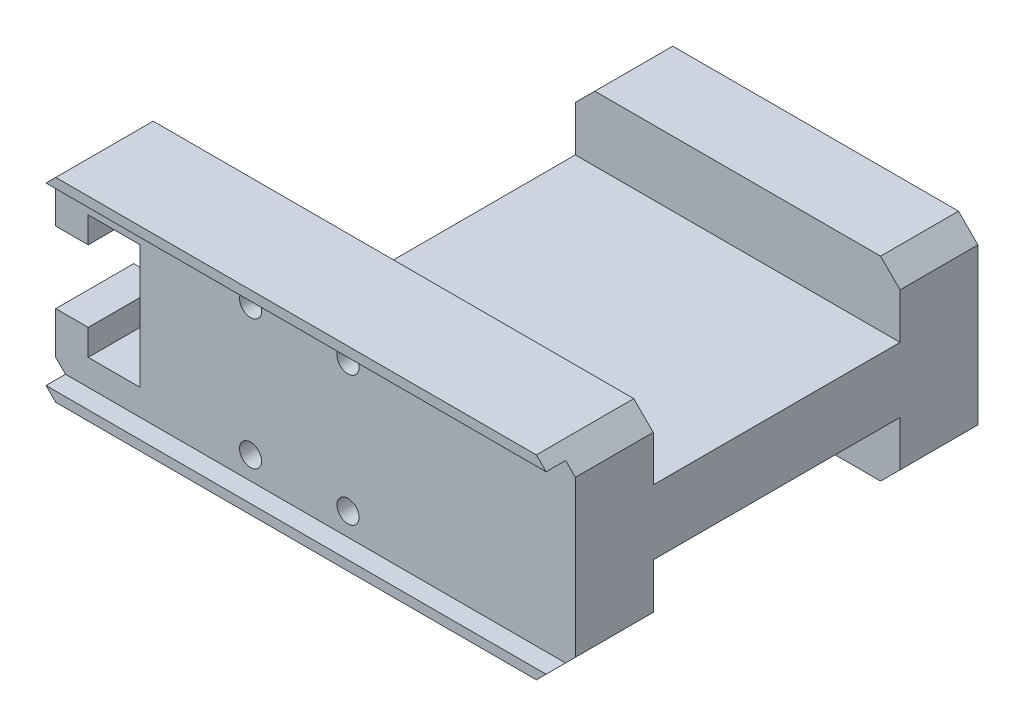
SolidWorks part; units mm, degrees
ref_plane "前视基准面" through (0, 0, 0) normal (0, 0, 1) x (1, 0, 0)
ref_plane "上视基准面" through (0, 0, 0) normal (0, 1, 0) x (1, 0, 0)
ref_plane "右视基准面" through (0, 0, 0) normal (1, 0, 0) x (0, 0, -1)
sketch "草图1" plane through (0, 0, 0) normal (0, 0, 1) x (1, 0, 0)
  line L1 (-40, -15) -> (40, -15)
  line L2 (-40, -15) -> (-40, 15)
  line L3 (-40, 15) -> (40, 15)
  line L4 (40, -15) -> (40, 15)
  line L5 (-40, -15) -> (40, 15) construction
  line L6 (-40, 15) -> (40, -15) construction
  point P0 (0, 0)
  dimension "D1" = 80
  dimension "D2" = 30
extrude "凸台-拉伸1" add sketch "草图1" along normal mid plane 65
sketch "草图2" plane through (0, 0, 32.5) normal (0, 0, 1) x (1, 0, 0)
  line L1 (-70.0409, -13.5) -> (70.0409, -13.5)
  line L2 (-70.0409, -13.5) -> (-70.0409, 13.5)
  line L3 (-70.0409, 13.5) -> (70.0409, 13.5)
  line L4 (70.0409, -13.5) -> (70.0409, 13.5)
  line L5 (-70.0409, -13.5) -> (70.0409, 13.5) construction
  line L6 (-70.0409, 13.5) -> (70.0409, -13.5) construction
  point P0 (0, 0)
  dimension "D1" = 27
extrude "切除-拉伸1" cut sketch "草图2" against normal blind 3
hole_wizard "Ø3.4 (3.4) 直径孔1" positions "草图4" profile "草图3" hole size "Ø3.4" standard "GB"
sketch "草图4" plane through (30.1404, -0.2316, 29.5) normal (0, 0, -1) x (-1, 0, 0)
  line L0 (70.1404, 15.2316) -> (70.1404, -14.7684) construction
  point P0 (25.1404, 10.2316)
  point P1 (40.1404, 10.2316)
  point P3 (40.1404, -9.7684)
  point P5 (25.1404, -9.7684)
  dimension "D1" = 15
  dimension "D2" = 30
  dimension "D3" = 20
  dimension "D4" = 10
sketch "草图3" plane through (5, 10, 29.5) normal (1, 0, 0) x (0, -1, 0)
  line L0 (0, 0) -> (0, 21.0215)
  line L1 (0, 21.0215) -> (1.7, 20)
  line L2 (1.7, 20) -> (1.7, 0)
  line L5 (1.7, 0) -> (0, 0)
  line L10 (0, 21.0215) -> (-1.7, 20) construction
  line L11 (0, -6.35) -> (0, 107.95) construction
  dimension "孔直径" = 3.4
  dimension "孔深度" = 20
  dimension "导头角度" = 118
sketch "草图5" plane through (0, 0, -32.5) normal (0, 0, -1) x (-1, 0, 0)
  line L0 (40, 15) -> (40, -15) construction
  line L1 (35, -5.5) -> (45, -5.5)
  line L2 (35, -5.5) -> (35, 5.5)
  line L3 (35, 5.5) -> (45, 5.5)
  line L4 (45, -5.5) -> (45, 5.5)
  line L5 (35, -5.5) -> (45, 5.5) construction
  line L6 (35, 5.5) -> (45, -5.5) construction
  point P0 (40, 0)
  dimension "D1" = 11
  dimension "D2" = 5
extrude "切除-拉伸2" cut sketch "草图5" against normal through all
sketch "草图6" plane through (0, 0, -32.5) normal (0, 0, -1) x (-1, 0, 0)
  line L0 (35, 5.5) -> (35, -5.5) construction
  line L1 (27, -9.5) -> (35, -9.5)
  line L2 (27, -9.5) -> (27, 9.5)
  line L3 (27, 9.5) -> (35, 9.5)
  line L4 (35, -9.5) -> (35, 9.5)
  line L5 (27, -9.5) -> (35, 9.5) construction
  line L6 (27, 9.5) -> (35, -9.5) construction
  point P0 (31, 0)
  dimension "D1" = 8
  dimension "D2" = 19
extrude "切除-拉伸3" cut sketch "草图6" against normal through all
hole_wizard "M5 螺纹孔2" positions "草图10" profile "草图9" tap size "M5" standard "GB"
sketch "草图10" plane through (0, 0, -32.5) normal (0, 0, -1) x (-1, 0, 0)
  line L3 (-40, -15) -> (-40, 15) construction
  point P3 (-10, 0)
  dimension "D1" = 30
sketch "草图9" plane through (10, 0, -32.5) normal (1, 0, 0) x (0, 1, 0)
  line L0 (0, 0) -> (0, 21.2618)
  line L1 (0, 21.2618) -> (2.1, 20)
  line L2 (2.1, 20) -> (2.1, 0)
  line L5 (2.1, 0) -> (0, 0)
  line L10 (0, 21.2618) -> (-2.1, 20) construction
  line L11 (0, -6.35) -> (0, 107.95) construction
  dimension "螺纹孔钻头直径" = 4.2
  dimension "螺纹孔钻头深度" = 20
  dimension "导头角度" = 118
sketch "草图13" plane through (0, -15, 0) normal (0, -1, 0) x (1, 0, 0)
  line L0 (-40, -32.5) -> (40, -32.5) construction
  line L1 (-51.858, 17.5) -> (69.2984, 17.5)
  line L2 (-51.858, 17.5) -> (-51.858, -20.5)
  line L3 (-51.858, -20.5) -> (69.2984, -20.5)
  line L4 (69.2984, 17.5) -> (69.2984, -20.5)
  line L5 (-40, 32.5) -> (40, 32.5) construction
  dimension "D1" = 12
  dimension "D2" = 15
extrude "切除-拉伸4" cut sketch "草图13" against normal blind 10
mirror "镜向1" about plane through (0, 0, 0) normal (0, 1, 0) of "切除-拉伸4"
sketch "草图14" plane through (-5.75, 0, -32.5) normal (0, 0, 1) x (1, 0, 0)
  line L0 (45.75, -15) -> (45.75, 15) construction
  line L1 (-62.1057, 42.7143) -> (-4.25, 42.7143)
  line L2 (-62.1057, 42.7143) -> (-62.1057, -25.5531)
  line L3 (-62.1057, -25.5531) -> (-4.25, -25.5531)
  line L4 (-4.25, 42.7143) -> (-4.25, -25.5531)
  dimension "D1" = 50
extrude "切除-拉伸5" cut sketch "草图14" along normal up to surface (50 mm away)
chamfer "倒角1" distance 3 angle 45 8 edges at (-40, 15, 25) (-40, -15, 25) (40, -15, 25) (40, -15, -26.5) (40, 15, 25) (40, 15, -26.5) (-10, 15, -26.5) (-10, -15, -26.5)
